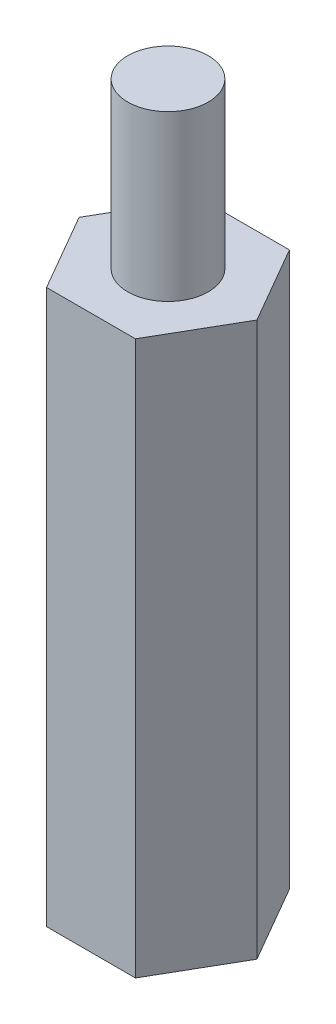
SolidWorks part; units mm, degrees
ref_plane "Front Plane" through (0, 0, 0) normal (0, 0, 1) x (1, 0, 0)
ref_plane "Top Plane" through (0, 0, 0) normal (0, 1, 0) x (1, 0, 0)
ref_plane "Right Plane" through (0, 0, 0) normal (1, 0, 0) x (0, 0, -1)
sketch "Sketch-Hex" plane through (0, 0, 0) normal (0, 1, 0) x (1, 0, 0)
  line L0 (0, 2.8194) -> (0, -2.8194) construction
  line L1 (3.2556, 0) -> (1.6278, 2.8194)
  line L2 (1.6278, 2.8194) -> (-1.6278, 2.8194)
  line L3 (-1.6278, 2.8194) -> (-3.2556, 0)
  line L4 (-3.2556, 0) -> (-1.6278, -2.8194)
  line L5 (-1.6278, -2.8194) -> (1.6278, -2.8194)
  line L6 (1.6278, -2.8194) -> (3.2556, 0)
  line L7 (-3.2556, 0) -> (3.2556, 0) construction
  circle A0 centre (0, 0) radius 2.8194 construction
  dimension "D1" = 5.6388
extrude "Boss-Extrude1" add sketch "Sketch-Hex" along normal blind 20.2692
sketch "Sketch3" plane through (0, 20.2692, 0) normal (0, 1, 0) x (1, 0, 0)
  line L0 (-3.2556, 0) -> (3.2556, 0) construction
  line L1 (0, -2.8194) -> (0, 2.8194) construction
  line L2 (-1.6278, -2.8194) -> (1.6278, -2.8194) construction
  line L3 (1.6278, 2.8194) -> (-1.6278, 2.8194) construction
  circle A0 centre (0, 0) radius 1.4732
  dimension "D1" = 2.9464
extrude "Boss-Extrude2" add sketch "Sketch3" along normal blind 6.0198
sketch "Sketch4" plane through (0, 0, 0) normal (0, -1, 0) x (1, 0, 0)
  line L0 (-3.2556, 0) -> (3.2556, 0) construction
  line L1 (0, -2.8194) -> (0, 2.8194) construction
  line L2 (1.6278, -2.8194) -> (-1.6278, -2.8194) construction
  line L3 (-1.6278, 2.8194) -> (1.6278, 2.8194) construction
  circle A0 centre (0, 0) radius 1.4732
  dimension "D1" = 2.9464
extrude "Cut-Extrude1" cut sketch "Sketch4" against normal blind 6.0198
